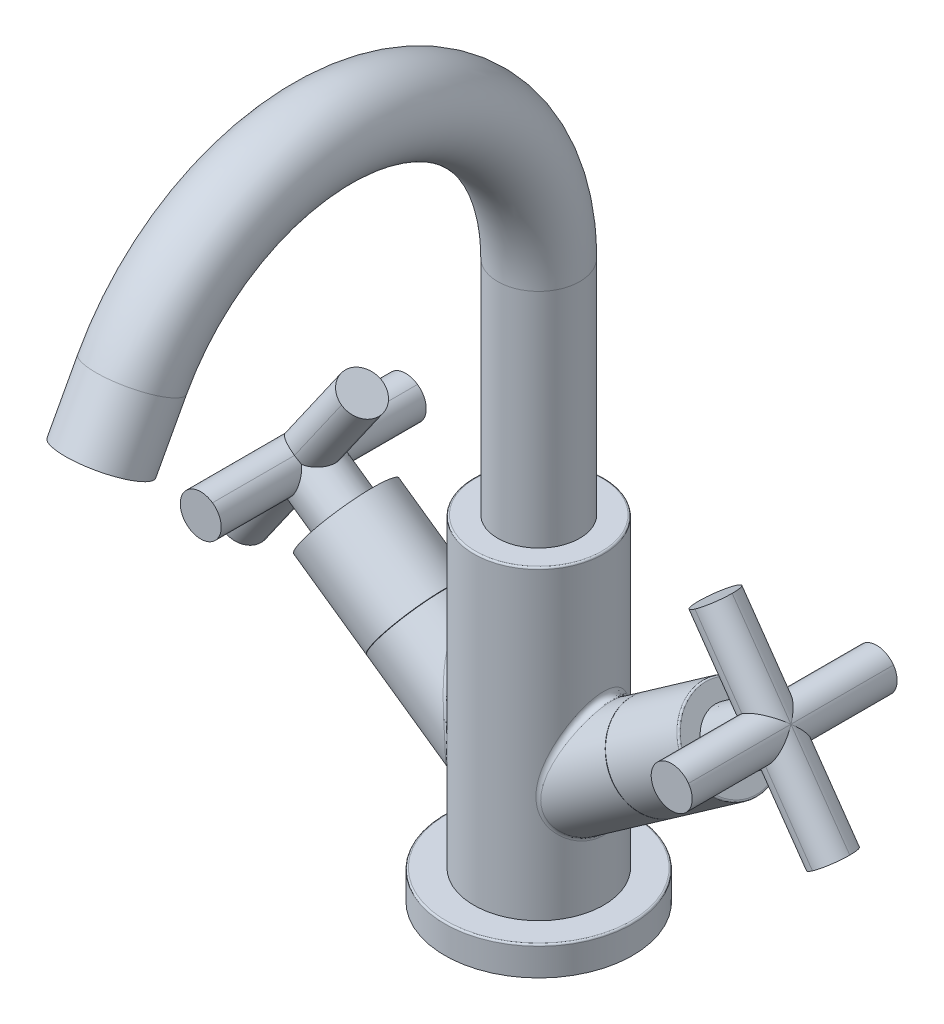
SolidWorks part; units mm, degrees
ref_plane "Front Plane" through (0, 0, 0) normal (0, 0, 1) x (1, 0, 0)
ref_plane "Top Plane" through (0, 0, 0) normal (0, 1, 0) x (1, 0, 0)
ref_plane "Right Plane" through (0, 0, 0) normal (1, 0, 0) x (0, 0, -1)
sketch "Sketch1" plane through (0, 0, 0) normal (0, 0, 1) x (1, 0, 0)
  line L0 (14, 200) -> (14, 213.1353)
  line L1 (-14, 213.1353) -> (-14, 200)
  line L2 (14, 213.1879) -> (14, 215.7624)
  line L3 (-14, 215.7624) -> (-14, 213.1879)
  line L4 (12, 163.0662) -> (12, 193.8645)
  line L5 (12, 221.898) -> (12, 225)
  line L6 (-12, 225) -> (-12, 221.898)
  line L7 (-12, 193.8645) -> (-12, 163.0662)
  line L8 (27.5, 0) -> (27.5, 8.5)
  line L9 (-27.5, 8.5) -> (-27.5, 0)
  line L10 (19, 65.0251) -> (19, 82.9)
  line L11 (19, 8.5) -> (19, 26.0343)
  line L12 (-19, 26.0343) -> (-19, 8.5)
  line L13 (-19, 82.9) -> (-19, 65.0251)
  line L14 (19, 83) -> (19, 98)
  line L15 (-19, 98) -> (-19, 83)
  line L16 (18, 82.9) -> (18, 83)
  line L17 (-18, 83) -> (-18, 82.9)
  line L18 (-42.6502, 43.5615) -> (-19.8331, 27.5848)
  line L19 (-22.1472, 63.3868) -> (-26.5901, 66.4978)
  line L20 (26.5901, 66.4978) -> (22.1472, 63.3868)
  line L21 (19.8331, 27.5848) -> (42.6502, 43.5615)
  line L22 (-64.0301, 58.5319) -> (-42.7321, 43.6189)
  line L23 (-26.672, 66.5551) -> (-47.9699, 81.4681)
  line L24 (47.9699, 81.4681) -> (26.672, 66.5551)
  line L25 (42.7321, 43.6189) -> (64.0301, 58.5319)
  line L26 (-42.1585, 44.438) -> (-42.0766, 44.3807)
  line L27 (-27.1636, 65.6786) -> (-27.2456, 65.736)
  line L28 (27.2456, 65.736) -> (27.1636, 65.6786)
  line L29 (42.0766, 44.3807) -> (42.1585, 44.438)
  line L30 (12, 98) -> (12, 163.0662)
  line L31 (-12, 163.0662) -> (-12, 98)
  line L34 (59.2319, 81.1747) -> (51.8129, 75.9798)
  line L35 (60.1871, 64.0202) -> (67.6062, 69.2151)
  line L36 (67.5327, 69.2207) -> (80.5797, 50.5876)
  line L37 (90.4095, 57.4706) -> (73.2022, 82.0451)
  line L38 (73.2022, 82.0451) -> (55.9949, 106.6197)
  line L39 (46.1651, 99.7368) -> (59.2121, 81.1037)
  line L40 (-67.6062, 69.2151) -> (-60.1871, 64.0202)
  line L41 (-51.8129, 75.9798) -> (-59.2319, 81.1747)
  line L42 (-73.2022, 82.0451) -> (-90.4095, 57.4706)
  line L43 (-80.5797, 50.5876) -> (-67.5327, 69.2207)
  line L44 (-59.2121, 81.1037) -> (-46.1651, 99.7368)
  line L45 (-55.9949, 106.6197) -> (-73.2022, 82.0451)
  line L48 (14, 213.1353) -> (13.9886, 213.615)
  line L49 (13.9886, 213.615) -> (13.7171, 215.518)
  line L50 (13.7171, 215.518) -> (13.0902, 217.3593)
  line L51 (13.0902, 217.3593) -> (12.1244, 219.0913)
  line L52 (12.1244, 219.0913) -> (10.8445, 220.6689)
  line L53 (10.8445, 220.6689) -> (9.2837, 222.0515)
  line L54 (9.2837, 222.0515) -> (7.4825, 223.2031)
  line L55 (7.4825, 223.2031) -> (5.4875, 224.094)
  line L56 (5.4875, 224.094) -> (3.3504, 224.7011)
  line L57 (3.3504, 224.7011) -> (1.1265, 225.0086)
  line L58 (1.1265, 225.0086) -> (-1.1265, 225.0086)
  line L59 (-1.1265, 225.0086) -> (-3.3504, 224.7011)
  line L60 (-3.3504, 224.7011) -> (-5.4875, 224.094)
  line L61 (-5.4875, 224.094) -> (-7.4825, 223.2031)
  line L62 (-7.4825, 223.2031) -> (-9.2837, 222.0515)
  line L63 (-9.2837, 222.0515) -> (-10.8445, 220.6689)
  line L64 (-10.8445, 220.6689) -> (-12.1244, 219.0913)
  line L65 (-12.1244, 219.0913) -> (-13.0902, 217.3593)
  line L66 (-13.0902, 217.3593) -> (-13.7171, 215.518)
  line L67 (-13.7171, 215.518) -> (-13.9886, 213.615)
  line L68 (-13.9886, 213.615) -> (-14, 213.1353)
  line L69 (-2.2458, 188.2424) -> (0, 188.0881)
  line L70 (0, 188.0881) -> (2.2458, 188.2424)
  line L71 (2.2458, 188.2424) -> (4.4334, 188.7012)
  line L72 (4.4334, 188.7012) -> (6.5061, 189.4526)
  line L73 (6.5061, 189.4526) -> (8.4104, 190.4772)
  line L74 (8.4104, 190.4772) -> (10.0968, 191.7484)
  line L75 (10.0968, 191.7484) -> (11.5218, 193.2333)
  line L76 (11.5218, 193.2333) -> (12.6483, 194.8935)
  line L77 (12.6483, 194.8935) -> (13.4473, 196.6859)
  line L78 (13.4473, 196.6859) -> (13.8979, 198.5642)
  line L79 (13.8979, 198.5642) -> (13.9886, 200.4796)
  line L80 (13.9886, 200.4796) -> (13.7171, 202.3827)
  line L81 (13.7171, 202.3827) -> (13.0902, 204.224)
  line L82 (13.0902, 204.224) -> (12.1244, 205.9559)
  line L83 (12.1244, 205.9559) -> (10.8445, 207.5336)
  line L84 (10.8445, 207.5336) -> (9.2837, 208.9162)
  line L85 (9.2837, 208.9162) -> (7.4825, 210.0678)
  line L86 (7.4825, 210.0678) -> (5.4875, 210.9587)
  line L87 (5.4875, 210.9587) -> (3.3504, 211.5657)
  line L88 (3.3504, 211.5657) -> (1.1265, 211.8732)
  line L89 (1.1265, 211.8732) -> (-1.1265, 211.8732)
  line L90 (-1.1265, 211.8732) -> (-3.3504, 211.5657)
  line L91 (-3.3504, 211.5657) -> (-5.4875, 210.9587)
  line L92 (-5.4875, 210.9587) -> (-7.4825, 210.0678)
  line L93 (-7.4825, 210.0678) -> (-9.2837, 208.9162)
  line L94 (-9.2837, 208.9162) -> (-10.8445, 207.5336)
  line L95 (-10.8445, 207.5336) -> (-12.1244, 205.9559)
  line L96 (-12.1244, 205.9559) -> (-13.0902, 204.224)
  line L97 (-13.0902, 204.224) -> (-13.7171, 202.3827)
  line L98 (-13.7171, 202.3827) -> (-13.9886, 200.4796)
  line L99 (-13.9886, 200.4796) -> (-13.8979, 198.5642)
  line L100 (-13.8979, 198.5642) -> (-13.4473, 196.6859)
  line L101 (-13.4473, 196.6859) -> (-12.6483, 194.8935)
  line L102 (-12.6483, 194.8935) -> (-11.5218, 193.2333)
  line L103 (-11.5218, 193.2333) -> (-10.0968, 191.7484)
  line L104 (-10.0968, 191.7484) -> (-8.4104, 190.4772)
  line L105 (-8.4104, 190.4772) -> (-6.5061, 189.4526)
  line L106 (-6.5061, 189.4526) -> (-4.4334, 188.7012)
  line L107 (-4.4334, 188.7012) -> (-2.2458, 188.2424)
  line L108 (1.9641, 190.7911) -> (0, 190.6407)
  line L109 (0, 190.6407) -> (-1.9641, 190.7911)
  line L110 (-1.9641, 190.7911) -> (-3.8651, 191.2375)
  line L111 (-3.8651, 191.2375) -> (-5.6419, 191.9655)
  line L112 (-5.6419, 191.9655) -> (-7.2373, 192.9518)
  line L113 (-7.2373, 192.9518) -> (-8.6001, 194.1646)
  line L114 (-8.6001, 194.1646) -> (-9.6866, 195.5649)
  line L115 (-9.6866, 195.5649) -> (-10.4616, 197.1078)
  line L116 (-10.4616, 197.1078) -> (-10.9004, 198.7437)
  line L117 (-10.9004, 198.7437) -> (-10.9889, 200.4199)
  line L118 (-10.9889, 200.4199) -> (-10.7242, 202.0827)
  line L119 (-10.7242, 202.0827) -> (-10.1148, 203.6785)
  line L120 (-10.1148, 203.6785) -> (-9.1803, 205.156)
  line L121 (-9.1803, 205.156) -> (-7.9507, 206.4679)
  line L122 (-7.9507, 206.4679) -> (-6.4656, 207.5719)
  line L123 (-6.4656, 207.5719) -> (-4.7727, 208.4325)
  line L124 (-4.7727, 208.4325) -> (-2.9264, 209.022)
  line L125 (-2.9264, 209.022) -> (-0.986, 209.3216)
  line L126 (-0.986, 209.3216) -> (0.986, 209.3216)
  line L127 (0.986, 209.3216) -> (2.9264, 209.022)
  line L128 (2.9264, 209.022) -> (4.7727, 208.4325)
  line L129 (4.7727, 208.4325) -> (6.4656, 207.5719)
  line L130 (6.4656, 207.5719) -> (7.9507, 206.4679)
  line L131 (7.9507, 206.4679) -> (9.1803, 205.156)
  line L132 (9.1803, 205.156) -> (10.1148, 203.6785)
  line L133 (10.1148, 203.6785) -> (10.7242, 202.0827)
  line L134 (10.7242, 202.0827) -> (10.9889, 200.4199)
  line L135 (10.9889, 200.4199) -> (10.9004, 198.7437)
  line L136 (10.9004, 198.7437) -> (10.4616, 197.1078)
  line L137 (10.4616, 197.1078) -> (9.6866, 195.5649)
  line L138 (9.6866, 195.5649) -> (8.6001, 194.1646)
  line L139 (8.6001, 194.1646) -> (7.2373, 192.9518)
  line L140 (7.2373, 192.9518) -> (5.6419, 191.9655)
  line L141 (5.6419, 191.9655) -> (3.8651, 191.2375)
  line L142 (3.8651, 191.2375) -> (1.9641, 190.7911)
  line L143 (-1.8925, 192.1707) -> (0, 192.017)
  line L144 (0, 192.017) -> (1.8925, 192.1707)
  line L145 (1.8925, 192.1707) -> (3.7166, 192.6264)
  line L146 (3.7166, 192.6264) -> (5.4064, 193.3676)
  line L147 (5.4064, 193.3676) -> (6.9008, 194.3676)
  line L148 (6.9008, 194.3676) -> (8.1458, 195.59)
  line L149 (8.1458, 195.59) -> (9.0963, 196.9909)
  line L150 (9.0963, 196.9909) -> (9.7181, 198.5195)
  line L151 (9.7181, 198.5195) -> (9.9887, 200.1206)
  line L152 (9.9887, 200.1206) -> (9.8982, 201.7363)
  line L153 (9.8982, 201.7363) -> (9.45, 203.3082)
  line L154 (9.45, 203.3082) -> (8.6603, 204.7796)
  line L155 (8.6603, 204.7796) -> (7.5575, 206.0973)
  line L156 (7.5575, 206.0973) -> (6.1816, 207.2135)
  line L157 (6.1816, 207.2135) -> (4.5823, 208.088)
  line L158 (4.5823, 208.088) -> (2.8173, 208.6892)
  line L159 (2.8173, 208.6892) -> (0.9506, 208.9954)
  line L160 (0.9506, 208.9954) -> (-0.9506, 208.9954)
  line L161 (-0.9506, 208.9954) -> (-2.8173, 208.6892)
  line L162 (-2.8173, 208.6892) -> (-4.5823, 208.088)
  line L163 (-4.5823, 208.088) -> (-6.1816, 207.2135)
  line L164 (-6.1816, 207.2135) -> (-7.5575, 206.0973)
  line L165 (-7.5575, 206.0973) -> (-8.6603, 204.7796)
  line L166 (-8.6603, 204.7796) -> (-9.45, 203.3082)
  line L167 (-9.45, 203.3082) -> (-9.8982, 201.7363)
  line L168 (-9.8982, 201.7363) -> (-9.9887, 200.1206)
  line L169 (-9.9887, 200.1206) -> (-9.7181, 198.5195)
  line L170 (-9.7181, 198.5195) -> (-9.0963, 196.9909)
  line L171 (-9.0963, 196.9909) -> (-8.1458, 195.59)
  line L172 (-8.1458, 195.59) -> (-6.9008, 194.3676)
  line L173 (-6.9008, 194.3676) -> (-5.4064, 193.3676)
  line L174 (-5.4064, 193.3676) -> (-3.7166, 192.6264)
  line L175 (-3.7166, 192.6264) -> (-1.8925, 192.1707)
  line L176 (0, 192.2797) -> (1.8925, 192.4334)
  line L177 (1.8925, 192.4334) -> (3.7166, 192.8891)
  line L178 (3.7166, 192.8891) -> (5.4064, 193.6303)
  line L179 (5.4064, 193.6303) -> (6.9008, 194.6303)
  line L180 (6.9008, 194.6303) -> (8.1458, 195.8527)
  line L181 (8.1458, 195.8527) -> (9.0963, 197.2536)
  line L182 (9.0963, 197.2536) -> (9.7181, 198.7822)
  line L183 (9.7181, 198.7822) -> (9.9887, 200.3833)
  line L184 (9.9887, 200.3833) -> (10, 200.7881)
  line L185 (-10, 200.7881) -> (-9.9887, 200.3833)
  line L186 (-9.9887, 200.3833) -> (-9.7181, 198.7822)
  line L187 (-9.7181, 198.7822) -> (-9.0963, 197.2536)
  line L188 (-9.0963, 197.2536) -> (-8.1458, 195.8527)
  line L189 (-8.1458, 195.8527) -> (-6.9008, 194.6303)
  line L190 (-6.9008, 194.6303) -> (-5.4064, 193.6303)
  line L191 (-5.4064, 193.6303) -> (-3.7166, 192.8891)
  line L192 (-3.7166, 192.8891) -> (-1.8925, 192.4334)
  line L193 (-1.8925, 192.4334) -> (0, 192.2797)
  line L194 (-2.3925, 207.9754) -> (-3.3925, 207.9754)
  line L195 (-3.3925, 207.9754) -> (-3.3925, 207.1246)
  line L196 (-3.3925, 207.1246) -> (-2.3925, 207.1246)
  line L197 (-2.3925, 207.1246) -> (-2.3925, 207.9754)
  line L198 (-1.4284, 205.7214) -> (-2.4284, 205.7214)
  line L199 (-2.4284, 205.7214) -> (-2.4284, 204.8706)
  line L200 (-2.4284, 204.8706) -> (-1.4284, 204.8706)
  line L201 (-1.4284, 204.8706) -> (-1.4284, 205.7214)
  line L202 (-3.3567, 205.1243) -> (-4.3567, 205.1243)
  line L203 (-4.3567, 205.1243) -> (-4.3567, 204.2734)
  line L204 (-4.3567, 204.2734) -> (-3.3567, 204.2734)
  line L205 (-3.3567, 204.2734) -> (-3.3567, 205.1243)
  line L206 (-6.8242, 204.8114) -> (-7.8242, 204.8114)
  line L207 (-7.8242, 204.8114) -> (-7.8242, 203.9606)
  line L208 (-7.8242, 203.9606) -> (-6.8242, 203.9606)
  line L209 (-6.8242, 203.9606) -> (-6.8242, 204.8114)
  line L210 (-4.3828, 203.6121) -> (-5.3828, 203.6121)
  line L211 (-5.3828, 203.6121) -> (-5.3828, 202.7613)
  line L212 (-5.3828, 202.7613) -> (-4.3828, 202.7613)
  line L213 (-4.3828, 202.7613) -> (-4.3828, 203.6121)
  line L214 (-5.4088, 202.1) -> (-6.4088, 202.1)
  line L215 (-6.4088, 202.1) -> (-6.4088, 201.2492)
  line L216 (-6.4088, 201.2492) -> (-5.4088, 201.2492)
  line L217 (-5.4088, 201.2492) -> (-5.4088, 202.1)
  line L218 (-7.8287, 199.964) -> (-8.8287, 199.964)
  line L219 (-8.8287, 199.964) -> (-8.8287, 199.1132)
  line L220 (-8.8287, 199.1132) -> (-7.8287, 199.1132)
  line L221 (-7.8287, 199.1132) -> (-7.8287, 199.964)
  line L222 (-5.0525, 200.3805) -> (-6.0525, 200.3805)
  line L223 (-6.0525, 200.3805) -> (-6.0525, 199.5297)
  line L224 (-6.0525, 199.5297) -> (-5.0525, 199.5297)
  line L225 (-5.0525, 199.5297) -> (-5.0525, 200.3805)
  line L226 (-4.6962, 198.661) -> (-5.6962, 198.661)
  line L227 (-5.6962, 198.661) -> (-5.6962, 197.8102)
  line L228 (-5.6962, 197.8102) -> (-4.6962, 197.8102)
  line L229 (-4.6962, 197.8102) -> (-4.6962, 198.661)
  line L230 (-4.9362, 195.7012) -> (-5.9362, 195.7012)
  line L231 (-5.9362, 195.7012) -> (-5.9362, 194.8504)
  line L232 (-5.9362, 194.8504) -> (-4.9362, 194.8504)
  line L233 (-4.9362, 194.8504) -> (-4.9362, 195.7012)
  line L234 (-3.1241, 197.5387) -> (-4.1241, 197.5387)
  line L235 (-4.1241, 197.5387) -> (-4.1241, 196.6878)
  line L236 (-4.1241, 196.6878) -> (-3.1241, 196.6878)
  line L237 (-3.1241, 196.6878) -> (-3.1241, 197.5387)
  line L238 (-1.5521, 196.4163) -> (-2.5521, 196.4163)
  line L239 (-2.5521, 196.4163) -> (-2.5521, 195.5655)
  line L240 (-2.5521, 195.5655) -> (-1.5521, 195.5655)
  line L241 (-1.5521, 195.5655) -> (-1.5521, 196.4163)
  line L242 (0.5, 194.0177) -> (-0.5, 194.0177)
  line L243 (-0.5, 194.0177) -> (-0.5, 193.1669)
  line L244 (-0.5, 193.1669) -> (0.5, 193.1669)
  line L245 (0.5, 193.1669) -> (0.5, 194.0177)
  line L246 (0.5, 196.4163) -> (-0.5, 196.4163)
  line L247 (-0.5, 196.4163) -> (-0.5, 195.5655)
  line L248 (-0.5, 195.5655) -> (0.5, 195.5655)
  line L249 (0.5, 195.5655) -> (0.5, 196.4163)
  line L250 (2.5521, 196.4163) -> (1.5521, 196.4163)
  line L251 (1.5521, 196.4163) -> (1.5521, 195.5655)
  line L252 (1.5521, 195.5655) -> (2.5521, 195.5655)
  line L253 (2.5521, 195.5655) -> (2.5521, 196.4163)
  line L254 (-1.4284, 203.1689) -> (-2.4284, 203.1689)
  line L255 (-2.4284, 203.1689) -> (-2.4284, 202.3181)
  line L256 (-2.4284, 202.3181) -> (-1.4284, 202.3181)
  line L257 (-1.4284, 202.3181) -> (-1.4284, 203.1689)
  line L258 (5.9362, 195.7012) -> (4.9362, 195.7012)
  line L259 (4.9362, 195.7012) -> (4.9362, 194.8504)
  line L260 (4.9362, 194.8504) -> (5.9362, 194.8504)
  line L261 (5.9362, 194.8504) -> (5.9362, 195.7012)
  line L262 (4.1241, 197.5387) -> (3.1241, 197.5387)
  line L263 (3.1241, 197.5387) -> (3.1241, 196.6878)
  line L264 (3.1241, 196.6878) -> (4.1241, 196.6878)
  line L265 (4.1241, 196.6878) -> (4.1241, 197.5387)
  line L266 (-2.4544, 201.6568) -> (-3.4544, 201.6568)
  line L267 (-3.4544, 201.6568) -> (-3.4544, 200.806)
  line L268 (-3.4544, 200.806) -> (-2.4544, 200.806)
  line L269 (-2.4544, 200.806) -> (-2.4544, 201.6568)
  line L270 (5.6962, 198.661) -> (4.6962, 198.661)
  line L271 (4.6962, 198.661) -> (4.6962, 197.8102)
  line L272 (4.6962, 197.8102) -> (5.6962, 197.8102)
  line L273 (5.6962, 197.8102) -> (5.6962, 198.661)
  line L274 (-2.0981, 199.9373) -> (-3.0981, 199.9373)
  line L275 (-3.0981, 199.9373) -> (-3.0981, 199.0864)
  line L276 (-3.0981, 199.0864) -> (-2.0981, 199.0864)
  line L277 (-2.0981, 199.0864) -> (-2.0981, 199.9373)
  line L278 (8.8287, 199.964) -> (7.8287, 199.964)
  line L279 (7.8287, 199.964) -> (7.8287, 199.1132)
  line L280 (7.8287, 199.1132) -> (8.8287, 199.1132)
  line L281 (8.8287, 199.1132) -> (8.8287, 199.964)
  line L282 (6.0525, 200.3805) -> (5.0525, 200.3805)
  line L283 (5.0525, 200.3805) -> (5.0525, 199.5297)
  line L284 (5.0525, 199.5297) -> (6.0525, 199.5297)
  line L285 (6.0525, 199.5297) -> (6.0525, 200.3805)
  line L286 (-0.5261, 198.815) -> (-1.5261, 198.815)
  line L287 (-1.5261, 198.815) -> (-1.5261, 197.9641)
  line L288 (-1.5261, 197.9641) -> (-0.5261, 197.9641)
  line L289 (-0.5261, 197.9641) -> (-0.5261, 198.815)
  line L290 (6.4088, 202.1) -> (5.4088, 202.1)
  line L291 (5.4088, 202.1) -> (5.4088, 201.2492)
  line L292 (5.4088, 201.2492) -> (6.4088, 201.2492)
  line L293 (6.4088, 201.2492) -> (6.4088, 202.1)
  line L294 (1.5261, 198.815) -> (0.5261, 198.815)
  line L295 (0.5261, 198.815) -> (0.5261, 197.9641)
  line L296 (0.5261, 197.9641) -> (1.5261, 197.9641)
  line L297 (1.5261, 197.9641) -> (1.5261, 198.815)
  line L298 (7.8242, 204.8114) -> (6.8242, 204.8114)
  line L299 (6.8242, 204.8114) -> (6.8242, 203.9606)
  line L300 (6.8242, 203.9606) -> (7.8242, 203.9606)
  line L301 (7.8242, 203.9606) -> (7.8242, 204.8114)
  line L302 (5.3828, 203.6121) -> (4.3828, 203.6121)
  line L303 (4.3828, 203.6121) -> (4.3828, 202.7613)
  line L304 (4.3828, 202.7613) -> (5.3828, 202.7613)
  line L305 (5.3828, 202.7613) -> (5.3828, 203.6121)
  line L306 (3.0981, 199.9373) -> (2.0981, 199.9373)
  line L307 (2.0981, 199.9373) -> (2.0981, 199.0864)
  line L308 (2.0981, 199.0864) -> (3.0981, 199.0864)
  line L309 (3.0981, 199.0864) -> (3.0981, 199.9373)
  line L310 (4.3567, 205.1243) -> (3.3567, 205.1243)
  line L311 (3.3567, 205.1243) -> (3.3567, 204.2734)
  line L312 (3.3567, 204.2734) -> (4.3567, 204.2734)
  line L313 (4.3567, 204.2734) -> (4.3567, 205.1243)
  line L314 (3.4544, 201.6568) -> (2.4544, 201.6568)
  line L315 (2.4544, 201.6568) -> (2.4544, 200.806)
  line L316 (2.4544, 200.806) -> (3.4544, 200.806)
  line L317 (3.4544, 200.806) -> (3.4544, 201.6568)
  line L318 (3.3925, 207.9754) -> (2.3925, 207.9754)
  line L319 (2.3925, 207.9754) -> (2.3925, 207.1246)
  line L320 (2.3925, 207.1246) -> (3.3925, 207.1246)
  line L321 (3.3925, 207.1246) -> (3.3925, 207.9754)
  line L322 (2.4284, 205.7214) -> (1.4284, 205.7214)
  line L323 (1.4284, 205.7214) -> (1.4284, 204.8706)
  line L324 (1.4284, 204.8706) -> (2.4284, 204.8706)
  line L325 (2.4284, 204.8706) -> (2.4284, 205.7214)
  line L326 (2.4284, 203.1689) -> (1.4284, 203.1689)
  line L327 (1.4284, 203.1689) -> (1.4284, 202.3181)
  line L328 (1.4284, 202.3181) -> (2.4284, 202.3181)
  line L329 (2.4284, 202.3181) -> (2.4284, 203.1689)
  line L330 (0.5, 206.3186) -> (-0.5, 206.3186)
  line L331 (-0.5, 206.3186) -> (-0.5, 205.4678)
  line L332 (-0.5, 205.4678) -> (0.5, 205.4678)
  line L333 (0.5, 205.4678) -> (0.5, 206.3186)
  line L334 (0.5, 201.2135) -> (-0.5, 201.2135)
  line L335 (-0.5, 201.2135) -> (-0.5, 200.3627)
  line L336 (-0.5, 200.3627) -> (0.5, 200.3627)
  line L337 (0.5, 200.3627) -> (0.5, 201.2135)
  line L338 (0.5, 203.7661) -> (-0.5, 203.7661)
  line L339 (-0.5, 203.7661) -> (-0.5, 202.9152)
  line L340 (-0.5, 202.9152) -> (0.5, 202.9152)
  line L341 (0.5, 202.9152) -> (0.5, 203.7661)
  line L342 (14, 213.1879) -> (13.9886, 213.6675)
  line L343 (13.9886, 213.6675) -> (13.7171, 215.5706)
  line L344 (13.7171, 215.5706) -> (13.0902, 217.4119)
  line L345 (13.0902, 217.4119) -> (12.1244, 219.1438)
  line L346 (12.1244, 219.1438) -> (10.8445, 220.7215)
  line L347 (10.8445, 220.7215) -> (9.2837, 222.104)
  line L348 (9.2837, 222.104) -> (7.4825, 223.2557)
  line L349 (7.4825, 223.2557) -> (5.4875, 224.1465)
  line L350 (5.4875, 224.1465) -> (3.3504, 224.7536)
  line L351 (3.3504, 224.7536) -> (1.1265, 225.0611)
  line L352 (1.1265, 225.0611) -> (-1.1265, 225.0611)
  line L353 (-1.1265, 225.0611) -> (-3.3504, 224.7536)
  line L354 (-3.3504, 224.7536) -> (-5.4875, 224.1465)
  line L355 (-5.4875, 224.1465) -> (-7.4825, 223.2557)
  line L356 (-7.4825, 223.2557) -> (-9.2837, 222.104)
  line L357 (-9.2837, 222.104) -> (-10.8445, 220.7215)
  line L358 (-10.8445, 220.7215) -> (-12.1244, 219.1438)
  line L359 (-12.1244, 219.1438) -> (-13.0902, 217.4119)
  line L360 (-13.0902, 217.4119) -> (-13.7171, 215.5706)
  line L361 (-13.7171, 215.5706) -> (-13.9886, 213.6675)
  line L362 (-13.9886, 213.6675) -> (-14, 213.1879)
  line L363 (14, 215.7624) -> (13.9886, 216.242)
  line L364 (13.9886, 216.242) -> (13.7171, 218.1451)
  line L365 (13.7171, 218.1451) -> (13.0902, 219.9864)
  line L366 (13.0902, 219.9864) -> (12.1244, 221.7183)
  line L367 (12.1244, 221.7183) -> (10.8445, 223.296)
  line L368 (10.8445, 223.296) -> (9.2837, 224.6786)
  line L369 (9.2837, 224.6786) -> (7.4825, 225.8302)
  line L370 (7.4825, 225.8302) -> (5.4875, 226.7211)
  line L371 (5.4875, 226.7211) -> (3.3504, 227.3281)
  line L372 (3.3504, 227.3281) -> (1.1265, 227.6356)
  line L373 (1.1265, 227.6356) -> (-1.1265, 227.6356)
  line L374 (-1.1265, 227.6356) -> (-3.3504, 227.3281)
  line L375 (-3.3504, 227.3281) -> (-5.4875, 226.7211)
  line L376 (-5.4875, 226.7211) -> (-7.4825, 225.8302)
  line L377 (-7.4825, 225.8302) -> (-9.2837, 224.6786)
  line L378 (-9.2837, 224.6786) -> (-10.8445, 223.296)
  line L379 (-10.8445, 223.296) -> (-12.1244, 221.7183)
  line L380 (-12.1244, 221.7183) -> (-13.0902, 219.9864)
  line L381 (-13.0902, 219.9864) -> (-13.7171, 218.1451)
  line L382 (-13.7171, 218.1451) -> (-13.9886, 216.242)
  line L383 (-13.9886, 216.242) -> (-14, 215.7624)
  line L384 (27.5, 0) -> (-27.5, 0)
  line L385 (27.5, 8.5) -> (-27.5, 8.5)
  line L386 (18.9131, 26.0477) -> (18.9265, 26.0343)
  line L387 (-18.9132, 26.0477) -> (-18.9265, 26.0343)
  line L388 (19, 82.9) -> (-19, 82.9)
  line L389 (19, 83) -> (-19, 83)
  line L390 (19, 98) -> (-19, 98)
  line L391 (-26.5901, 66.4978) -> (-26.694, 66.3493)
  line L392 (-26.694, 66.3493) -> (-27.0033, 65.9076)
  line L393 (-27.0033, 65.9076) -> (-27.5099, 65.1842)
  line L394 (-27.5099, 65.1842) -> (-28.2006, 64.1978)
  line L395 (-28.2006, 64.1978) -> (-29.0575, 62.9739)
  line L396 (-29.0575, 62.9739) -> (-30.0585, 61.5443)
  line L397 (-30.0585, 61.5443) -> (-31.1777, 59.946)
  line L398 (-31.1777, 59.946) -> (-32.386, 58.2203)
  line L399 (-32.386, 58.2203) -> (-33.6522, 56.412)
  line L400 (-33.6522, 56.412) -> (-34.9435, 54.5679)
  line L401 (-34.9435, 54.5679) -> (-36.2264, 52.7357)
  line L402 (-36.2264, 52.7357) -> (-37.4676, 50.963)
  line L403 (-37.4676, 50.963) -> (-38.6352, 49.2956)
  line L404 (-38.6352, 49.2956) -> (-39.6987, 47.7767)
  line L405 (-39.6987, 47.7767) -> (-40.6307, 46.4456)
  line L406 (-40.6307, 46.4456) -> (-41.4071, 45.3369)
  line L407 (-41.4071, 45.3369) -> (-42.0076, 44.4792)
  line L408 (-42.0076, 44.4792) -> (-42.4169, 43.8948)
  line L409 (-42.4169, 43.8948) -> (-42.6242, 43.5987)
  line L410 (-42.6242, 43.5987) -> (-42.6502, 43.5615)
  line L411 (26.5901, 66.4978) -> (26.694, 66.3493)
  line L412 (26.694, 66.3493) -> (27.0033, 65.9076)
  line L413 (27.0033, 65.9076) -> (27.5099, 65.1842)
  line L414 (27.5099, 65.1842) -> (28.2006, 64.1978)
  line L415 (28.2006, 64.1978) -> (29.0575, 62.9739)
  line L416 (29.0575, 62.9739) -> (30.0585, 61.5443)
  line L417 (30.0585, 61.5443) -> (31.1777, 59.946)
  line L418 (31.1777, 59.946) -> (32.386, 58.2203)
  line L419 (32.386, 58.2203) -> (33.6522, 56.412)
  line L420 (33.6522, 56.412) -> (34.9435, 54.5679)
  line L421 (34.9435, 54.5679) -> (36.2264, 52.7357)
  line L422 (36.2264, 52.7357) -> (37.4676, 50.963)
  line L423 (37.4676, 50.963) -> (38.6352, 49.2956)
  line L424 (38.6352, 49.2956) -> (39.6987, 47.7767)
  line L425 (39.6987, 47.7767) -> (40.6307, 46.4456)
  line L426 (40.6307, 46.4456) -> (41.4071, 45.3369)
  line L427 (41.4071, 45.3369) -> (42.0076, 44.4792)
  line L428 (42.0076, 44.4792) -> (42.4169, 43.8948)
  line L429 (42.4169, 43.8948) -> (42.6242, 43.5987)
  line L430 (42.6242, 43.5987) -> (42.6502, 43.5615)
  line L431 (-26.672, 66.5551) -> (-26.776, 66.4066)
  line L432 (-26.776, 66.4066) -> (-27.0852, 65.965)
  line L433 (-27.0852, 65.965) -> (-27.5918, 65.2415)
  line L434 (-27.5918, 65.2415) -> (-28.2825, 64.2551)
  line L435 (-28.2825, 64.2551) -> (-29.1394, 63.0313)
  line L436 (-29.1394, 63.0313) -> (-30.1404, 61.6017)
  line L437 (-30.1404, 61.6017) -> (-31.2596, 60.0033)
  line L438 (-31.2596, 60.0033) -> (-32.4679, 58.2776)
  line L439 (-32.4679, 58.2776) -> (-33.7341, 56.4693)
  line L440 (-33.7341, 56.4693) -> (-35.0254, 54.6252)
  line L441 (-35.0254, 54.6252) -> (-36.3083, 52.7931)
  line L442 (-36.3083, 52.7931) -> (-37.5495, 51.0204)
  line L443 (-37.5495, 51.0204) -> (-38.7171, 49.353)
  line L444 (-38.7171, 49.353) -> (-39.7806, 47.834)
  line L445 (-39.7806, 47.834) -> (-40.7126, 46.503)
  line L446 (-40.7126, 46.503) -> (-41.489, 45.3943)
  line L447 (-41.489, 45.3943) -> (-42.0895, 44.5366)
  line L448 (-42.0895, 44.5366) -> (-42.4988, 43.9521)
  line L449 (-42.4988, 43.9521) -> (-42.7061, 43.6561)
  line L450 (-42.7061, 43.6561) -> (-42.7321, 43.6189)
  line L451 (-47.9699, 81.4681) -> (-48.0739, 81.3196)
  line L452 (-48.0739, 81.3196) -> (-48.3832, 80.8779)
  line L453 (-48.3832, 80.8779) -> (-48.8897, 80.1545)
  line L454 (-48.8897, 80.1545) -> (-49.5804, 79.1681)
  line L455 (-49.5804, 79.1681) -> (-50.4374, 77.9443)
  line L456 (-50.4374, 77.9443) -> (-51.4384, 76.5146)
  line L457 (-51.4384, 76.5146) -> (-52.5576, 74.9163)
  line L458 (-52.5576, 74.9163) -> (-53.7659, 73.1906)
  line L459 (-53.7659, 73.1906) -> (-55.0321, 71.3823)
  line L460 (-55.0321, 71.3823) -> (-56.3233, 69.5382)
  line L461 (-56.3233, 69.5382) -> (-57.6062, 67.7061)
  line L462 (-57.6062, 67.7061) -> (-58.8475, 65.9334)
  line L463 (-58.8475, 65.9334) -> (-60.015, 64.2659)
  line L464 (-60.015, 64.2659) -> (-61.0786, 62.747)
  line L465 (-61.0786, 62.747) -> (-62.0106, 61.416)
  line L466 (-62.0106, 61.416) -> (-62.7869, 60.3073)
  line L467 (-62.7869, 60.3073) -> (-63.3875, 59.4496)
  line L468 (-63.3875, 59.4496) -> (-63.7967, 58.8651)
  line L469 (-63.7967, 58.8651) -> (-64.004, 58.5691)
  line L470 (-64.004, 58.5691) -> (-64.0301, 58.5319)
  line L471 (26.672, 66.5551) -> (26.776, 66.4066)
  line L472 (26.776, 66.4066) -> (27.0852, 65.965)
  line L473 (27.0852, 65.965) -> (27.5918, 65.2415)
  line L474 (27.5918, 65.2415) -> (28.2825, 64.2551)
  line L475 (28.2825, 64.2551) -> (29.1394, 63.0313)
  line L476 (29.1394, 63.0313) -> (30.1404, 61.6017)
  line L477 (30.1404, 61.6017) -> (31.2596, 60.0033)
  line L478 (31.2596, 60.0033) -> (32.4679, 58.2776)
  line L479 (32.4679, 58.2776) -> (33.7341, 56.4693)
  line L480 (33.7341, 56.4693) -> (35.0254, 54.6252)
  line L481 (35.0254, 54.6252) -> (36.3083, 52.7931)
  line L482 (36.3083, 52.7931) -> (37.5495, 51.0204)
  line L483 (37.5495, 51.0204) -> (38.7171, 49.353)
  line L484 (38.7171, 49.353) -> (39.7806, 47.834)
  line L485 (39.7806, 47.834) -> (40.7126, 46.503)
  line L486 (40.7126, 46.503) -> (41.489, 45.3943)
  line L487 (41.489, 45.3943) -> (42.0895, 44.5366)
  line L488 (42.0895, 44.5366) -> (42.4988, 43.9521)
  line L489 (42.4988, 43.9521) -> (42.7061, 43.6561)
  line L490 (42.7061, 43.6561) -> (42.7321, 43.6189)
  line L491 (47.9699, 81.4681) -> (48.0739, 81.3196)
  line L492 (48.0739, 81.3196) -> (48.3832, 80.8779)
  line L493 (48.3832, 80.8779) -> (48.8897, 80.1545)
  line L494 (48.8897, 80.1545) -> (49.5804, 79.1681)
  line L495 (49.5804, 79.1681) -> (50.4374, 77.9443)
  line L496 (50.4374, 77.9443) -> (51.4384, 76.5146)
  line L497 (51.4384, 76.5146) -> (52.5576, 74.9163)
  line L498 (52.5576, 74.9163) -> (53.7659, 73.1906)
  line L499 (53.7659, 73.1906) -> (55.0321, 71.3823)
  line L500 (55.0321, 71.3823) -> (56.3233, 69.5382)
  line L501 (56.3233, 69.5382) -> (57.6062, 67.7061)
  line L502 (57.6062, 67.7061) -> (58.8475, 65.9334)
  line L503 (58.8475, 65.9334) -> (60.015, 64.2659)
  line L504 (60.015, 64.2659) -> (61.0786, 62.747)
  line L505 (61.0786, 62.747) -> (62.0106, 61.416)
  line L506 (62.0106, 61.416) -> (62.7869, 60.3073)
  line L507 (62.7869, 60.3073) -> (63.3875, 59.4496)
  line L508 (63.3875, 59.4496) -> (63.7967, 58.8651)
  line L509 (63.7967, 58.8651) -> (64.004, 58.5691)
  line L510 (64.004, 58.5691) -> (64.0301, 58.5319)
  line L515 (90.4095, 57.4706) -> (90.3707, 57.4434)
  line L516 (90.3707, 57.4434) -> (90.0643, 57.2289)
  line L517 (90.0643, 57.2289) -> (89.4708, 56.8133)
  line L518 (89.4708, 56.8133) -> (88.6275, 56.2228)
  line L519 (88.6275, 56.2228) -> (87.5872, 55.4944)
  line L520 (87.5872, 55.4944) -> (86.4155, 54.6739)
  line L521 (86.4155, 54.6739) -> (85.186, 53.813)
  line L522 (85.186, 53.813) -> (83.9758, 52.9656)
  line L523 (83.9758, 52.9656) -> (82.861, 52.1851)
  line L524 (82.861, 52.1851) -> (81.9118, 51.5204)
  line L525 (81.9118, 51.5204) -> (81.1876, 51.0133)
  line L526 (81.1876, 51.0133) -> (80.7341, 50.6958)
  line L527 (80.7341, 50.6958) -> (80.5797, 50.5876)
  line L528 (46.1651, 99.7368) -> (46.3195, 99.8449)
  line L529 (46.3195, 99.8449) -> (46.773, 100.1624)
  line L530 (46.773, 100.1624) -> (47.4972, 100.6695)
  line L531 (47.4972, 100.6695) -> (48.4464, 101.3342)
  line L532 (48.4464, 101.3342) -> (49.5612, 102.1147)
  line L533 (49.5612, 102.1147) -> (50.7714, 102.9621)
  line L534 (50.7714, 102.9621) -> (52.001, 103.8231)
  line L535 (52.001, 103.8231) -> (53.1727, 104.6435)
  line L536 (53.1727, 104.6435) -> (54.2129, 105.3719)
  line L537 (54.2129, 105.3719) -> (55.0562, 105.9624)
  line L538 (55.0562, 105.9624) -> (55.6498, 106.378)
  line L539 (55.6498, 106.378) -> (55.9561, 106.5925)
  line L540 (55.9561, 106.5925) -> (55.9949, 106.6197)
  line L541 (-80.5797, 50.5876) -> (-80.7341, 50.6958)
  line L542 (-80.7341, 50.6958) -> (-81.1876, 51.0133)
  line L543 (-81.1876, 51.0133) -> (-81.9118, 51.5204)
  line L544 (-81.9118, 51.5204) -> (-82.861, 52.1851)
  line L545 (-82.861, 52.1851) -> (-83.9758, 52.9656)
  line L546 (-83.9758, 52.9656) -> (-85.186, 53.813)
  line L547 (-85.186, 53.813) -> (-86.4155, 54.6739)
  line L548 (-86.4155, 54.6739) -> (-87.5872, 55.4944)
  line L549 (-87.5872, 55.4944) -> (-88.6275, 56.2228)
  line L550 (-88.6275, 56.2228) -> (-89.4708, 56.8133)
  line L551 (-89.4708, 56.8133) -> (-90.0643, 57.2289)
  line L552 (-90.0643, 57.2289) -> (-90.3707, 57.4434)
  line L553 (-90.3707, 57.4434) -> (-90.4095, 57.4706)
  line L554 (-55.9949, 106.6197) -> (-55.9561, 106.5925)
  line L555 (-55.9561, 106.5925) -> (-55.6498, 106.378)
  line L556 (-55.6498, 106.378) -> (-55.0562, 105.9624)
  line L557 (-55.0562, 105.9624) -> (-54.2129, 105.3719)
  line L558 (-54.2129, 105.3719) -> (-53.1727, 104.6435)
  line L559 (-53.1727, 104.6435) -> (-52.001, 103.8231)
  line L560 (-52.001, 103.8231) -> (-50.7714, 102.9621)
  line L561 (-50.7714, 102.9621) -> (-49.5612, 102.1147)
  line L562 (-49.5612, 102.1147) -> (-48.4464, 101.3342)
  line L563 (-48.4464, 101.3342) -> (-47.4972, 100.6695)
  line L564 (-47.4972, 100.6695) -> (-46.773, 100.1624)
  line L565 (-46.773, 100.1624) -> (-46.3195, 99.8449)
  line L566 (-46.3195, 99.8449) -> (-46.1651, 99.7368)
  line L567 (-27.5, 0) -> (27.5, 0)
  line L574 (0, 0) -> (0, 237) construction
  line L575 (-73.2022, 82.0451) -> (0, 30.7884) construction
  line L576 (0, 30.1002) -> (73.5038, 81.5681) construction
  arc A0 (12, 225) -> (-12, 225) centre (0, 225) ccw
  circle A1 centre (68.2873, 78.6037) radius 6
  circle A2 centre (-68.2873, 78.6036) radius 6
  spline S0 degree 3 poles (-19.0066, 65.0118) (-19.0023, 64.9669) (-18.9754, 64.6858) (-19.1461, 64.1481) (-19.5697, 63.5331) (-20.213, 63.1179) (-20.8968, 62.9727) (-21.5009, 63.0532) (-21.9156, 63.2121) (-22.1096, 63.3591) (-22.1742, 63.408) knots 0 0 0 0 0.030683 0.192348 0.368782 0.533189 0.701933 0.834283 0.944803 1 1 1 1
  spline S1 degree 3 poles (-19.8505, 27.5666) (-19.7311, 27.4864) (-19.3966, 27.2619) (-19.1126, 26.7135) (-18.9764, 26.2608) (-18.9914, 26.058) (-18.9917, 26.0538) knots 0 0 0 0 0.236552 0.662253 0.993 1 1 1 1
  spline S2 degree 3 poles (18.9912, 26.0324) (19.021, 26.2511) (19.0834, 26.7088) (19.4049, 27.2622) (19.7283, 27.482) (19.8518, 27.5659) knots 0 0 0 0 0.361449 0.756313 1 1 1 1
  spline S3 degree 3 poles (22.1634, 63.4054) (22.108, 63.3611) (21.8779, 63.1771) (21.3625, 63.0094) (20.6591, 62.9923) (19.9807, 63.2345) (19.4661, 63.665) (19.1606, 64.1558) (19.0137, 64.6048) (18.9999, 64.8867) (18.9937, 65.0126) knots 0 0 0 0 0.04838 0.200902 0.358443 0.523192 0.681258 0.807671 0.914101 1 1 1 1
  spline S4 degree 3 poles (59.2588, 81.1364) (59.2674, 81.1357) (59.4613, 81.1211) (60.0023, 81.0836) (61.0862, 81.0311) (62.0819, 81.0269) (62.7267, 81.0712) (62.8211, 81.0777) knots 0 0 0 0 0.007268 0.163613 0.456283 0.920362 1 1 1 1
  spline S5 degree 3 poles (68.7426, 72.621) (68.4929, 71.9852) (68.2433, 71.3494) (68.084, 70.9103) knots 0 0 0 0 0.508691 0.508691 0.508691 0.508691
  spline S6 degree 3 poles (68.084, 70.9103) (67.9778, 70.6174) (67.9117, 70.4121) (67.7198, 69.7436) knots 0.508691 0.508691 0.508691 0.508691 0.847859 0.847859 0.847859 0.847859
  spline S7 degree 3 poles (67.7198, 69.7436) (67.6368, 69.4542) (67.5301, 69.078) (67.5742, 69.2349) knots 0.847859 0.847859 0.847859 0.847859 0.994683 0.994683 0.994683 0.994683
  spline S8 degree 3 poles (67.5742, 69.2349) (67.5758, 69.2406) (67.5775, 69.247) (67.5793, 69.2534) knots 0.994683 0.994683 0.994683 0.994683 1 1 1 1
  spline S9 degree 3 poles (-62.8211, 81.0777) (-62.1383, 81.0605) (-61.4555, 81.0434) (-60.9883, 81.0439) knots 0 0 0 0 0.508693 0.508693 0.508693 0.508693
  spline S10 degree 3 poles (-60.9883, 81.0439) (-60.6768, 81.0442) (-60.4612, 81.0524) (-59.7674, 81.1008) knots 0.508693 0.508693 0.508693 0.508693 0.847859 0.847859 0.847859 0.847859
  spline S11 degree 3 poles (-59.7674, 81.1008) (-59.4671, 81.1217) (-59.0771, 81.1501) (-59.2397, 81.1378) knots 0.847859 0.847859 0.847859 0.847859 0.994683 0.994683 0.994683 0.994683
  spline S12 degree 3 poles (-59.2397, 81.1378) (-59.2455, 81.1374) (-59.2521, 81.1369) (-59.2588, 81.1364) knots 0.994683 0.994683 0.994683 0.994683 1 1 1 1
  spline S13 degree 3 poles (-67.5793, 69.2534) (-67.5817, 69.2617) (-67.6342, 69.4489) (-67.784, 69.9701) (-68.1054, 71.0066) (-68.442, 71.9437) (-68.7042, 72.5344) (-68.7426, 72.621) knots 0 0 0 0 0.007271 0.163615 0.456284 0.920362 1 1 1 1
sketch "Sketch2" plane through (0, 0, 0) normal (1, 0, 0) x (0, 0, -1)
  line L0 (14, 70) -> (14, 55.087)
  line L1 (-14, 55.087) -> (-14, 70)
  line L2 (14, 55.0297) -> (14, 40.3403)
  line L3 (-14, 40.3302) -> (-14, 55.0297)
  line L4 (-27.5, 0) -> (-27.5, 8.5)
  line L5 (27.5, 8.5) -> (27.5, 0)
  line L6 (-19, 8.5) -> (-19, 72.6037)
  line L7 (19, 28.2456) -> (19, 8.5)
  line L8 (19, 72.6037) -> (19, 46.4836)
  line L9 (-19, 84.6036) -> (-19, 98)
  line L10 (19, 98) -> (19, 84.6036)
  line L17 (-12, 98) -> (-12, 163.0662)
  line L18 (12, 163.0662) -> (12, 98)
  line L23 (23.1276, 38.7662) -> (18.9578, 28.9428)
  line L24 (6, 73.6887) -> (6, 54.0291)
  line L25 (-6, 54.0291) -> (-6, 73.6887)
  line L26 (4.9149, 84.6036) -> (30, 84.6036)
  line L27 (30, 72.6037) -> (6, 72.6037)
  line L28 (-30, 84.6036) -> (-4.9149, 84.6036)
  line L29 (-6, 72.6037) -> (-30, 72.6037)
  line L30 (-6, 84.6036) -> (-6, 103.1782)
  line L31 (6, 103.1782) -> (6, 84.6036)
  line L32 (7.3, 72.6037) -> (7.3, 70)
  line L33 (-7.3, 70) -> (-7.3, 72.6037)
  line L34 (27.4998, 0) -> (27.5, 0)
  line L35 (-27.5, 0) -> (-27.4998, 0)
  line L36 (-13.6344, 72.6037) -> (-13.8979, 71.3823)
  line L37 (-13.8979, 71.3823) -> (-13.9886, 69.5382)
  line L38 (-13.9886, 69.5382) -> (-13.7171, 67.7061)
  line L39 (-13.7171, 67.7061) -> (-13.0902, 65.9334)
  line L40 (-13.0902, 65.9334) -> (-12.1244, 64.2659)
  line L41 (-12.1244, 64.2659) -> (-10.8445, 62.747)
  line L42 (-10.8445, 62.747) -> (-9.2837, 61.416)
  line L43 (-9.2837, 61.416) -> (-7.4825, 60.3073)
  line L44 (-7.4825, 60.3073) -> (-6, 59.6385)
  line L45 (6, 59.6385) -> (7.4825, 60.3073)
  line L46 (7.4825, 60.3073) -> (9.2837, 61.416)
  line L47 (9.2837, 61.416) -> (10.8445, 62.747)
  line L48 (10.8445, 62.747) -> (12.1244, 64.2659)
  line L49 (12.1244, 64.2659) -> (13.0902, 65.9334)
  line L50 (13.0902, 65.9334) -> (13.7171, 67.7061)
  line L51 (13.7171, 67.7061) -> (13.9886, 69.5382)
  line L52 (13.9886, 69.5382) -> (13.8979, 71.3823)
  line L53 (13.8979, 71.3823) -> (13.6344, 72.6037)
  line L54 (-14, 55.087) -> (-13.9886, 54.6252)
  line L55 (-13.9886, 54.6252) -> (-13.7171, 52.7931)
  line L56 (-13.7171, 52.7931) -> (-13.0902, 51.0204)
  line L57 (-13.0902, 51.0204) -> (-12.1244, 49.353)
  line L58 (-12.1244, 49.353) -> (-10.8445, 47.834)
  line L59 (-10.8445, 47.834) -> (-9.2837, 46.503)
  line L60 (-9.2837, 46.503) -> (-7.4825, 45.3943)
  line L61 (-7.4825, 45.3943) -> (-5.4875, 44.5366)
  line L62 (-5.4875, 44.5366) -> (-3.3504, 43.9521)
  line L63 (-3.3504, 43.9521) -> (-1.1265, 43.6561)
  line L64 (-1.1265, 43.6561) -> (1.1265, 43.6561)
  line L65 (1.1265, 43.6561) -> (3.3504, 43.9521)
  line L66 (3.3504, 43.9521) -> (5.4875, 44.5366)
  line L67 (5.4875, 44.5366) -> (7.4825, 45.3943)
  line L68 (7.4825, 45.3943) -> (9.2837, 46.503)
  line L69 (9.2837, 46.503) -> (10.8445, 47.834)
  line L70 (10.8445, 47.834) -> (12.1244, 49.353)
  line L71 (12.1244, 49.353) -> (13.0902, 51.0204)
  line L72 (13.0902, 51.0204) -> (13.7171, 52.7931)
  line L73 (13.7171, 52.7931) -> (13.9886, 54.6252)
  line L74 (13.9886, 54.6252) -> (14, 55.087)
  line L75 (-14, 55.0297) -> (-13.9886, 54.5679)
  line L76 (-13.9886, 54.5679) -> (-13.7171, 52.7357)
  line L77 (-13.7171, 52.7357) -> (-13.0902, 50.963)
  line L78 (-13.0902, 50.963) -> (-12.1244, 49.2956)
  line L79 (-12.1244, 49.2956) -> (-10.8445, 47.7767)
  line L80 (-10.8445, 47.7767) -> (-9.2837, 46.4456)
  line L81 (-9.2837, 46.4456) -> (-7.4825, 45.3369)
  line L82 (-7.4825, 45.3369) -> (-5.4875, 44.4792)
  line L83 (-5.4875, 44.4792) -> (-3.3504, 43.8948)
  line L84 (-3.3504, 43.8948) -> (-1.1265, 43.5987)
  line L85 (-1.1265, 43.5987) -> (1.1265, 43.5987)
  line L86 (1.1265, 43.5987) -> (3.3504, 43.8948)
  line L87 (3.3504, 43.8948) -> (5.4875, 44.4792)
  line L88 (5.4875, 44.4792) -> (7.4825, 45.3369)
  line L89 (7.4825, 45.3369) -> (9.2837, 46.4456)
  line L90 (9.2837, 46.4456) -> (10.8445, 47.7767)
  line L91 (10.8445, 47.7767) -> (12.1244, 49.2956)
  line L92 (12.1244, 49.2956) -> (13.0902, 50.963)
  line L93 (13.0902, 50.963) -> (13.7171, 52.7357)
  line L94 (13.7171, 52.7357) -> (13.9886, 54.5679)
  line L95 (13.9886, 54.5679) -> (14, 55.0297)
  line L96 (-13.9754, 40.0468) -> (-13.9811, 40.3306)
  line L97 (-27.4998, 0) -> (27.4998, 0)
  line L98 (-27.5, 8.5) -> (27.5, 8.5)
  line L99 (-19, 98) -> (-6, 98)
  line L100 (6, 98) -> (19, 98)
  line L184 (-13.9703, 40.3389) -> (-13.9766, 40.106)
  line L187 (1.4921, 50.6958) -> (0, 50.5876)
  line L188 (0, 50.5876) -> (-1.4921, 50.6958)
  line L189 (-1.4921, 50.6958) -> (-2.8905, 51.0133)
  line L190 (-2.8905, 51.0133) -> (-4.1073, 51.5204)
  line L191 (-4.1073, 51.5204) -> (-5.066, 52.1851)
  line L192 (-5.066, 52.1851) -> (-5.7063, 52.9656)
  line L193 (-5.7063, 52.9656) -> (-5.9882, 53.813)
  line L194 (-5.9882, 53.813) -> (-5.8937, 54.6739)
  line L195 (-5.8937, 54.6739) -> (-5.429, 55.4944)
  line L196 (-5.429, 55.4944) -> (-4.6231, 56.2228)
  line L197 (-4.6231, 56.2228) -> (-3.5267, 56.8133)
  line L198 (-3.5267, 56.8133) -> (-2.2087, 57.2289)
  line L199 (-2.2087, 57.2289) -> (-0.752, 57.4434)
  line L200 (-0.752, 57.4434) -> (0.752, 57.4434)
  line L201 (0.752, 57.4434) -> (2.2087, 57.2289)
  line L202 (2.2087, 57.2289) -> (3.5267, 56.8133)
  line L203 (3.5267, 56.8133) -> (4.6231, 56.2228)
  line L204 (4.6231, 56.2228) -> (5.429, 55.4944)
  line L205 (5.429, 55.4944) -> (5.8937, 54.6739)
  line L206 (5.8937, 54.6739) -> (5.9882, 53.813)
  line L207 (5.9882, 53.813) -> (5.7063, 52.9656)
  line L208 (5.7063, 52.9656) -> (5.066, 52.1851)
  line L209 (5.066, 52.1851) -> (4.1073, 51.5204)
  line L210 (4.1073, 51.5204) -> (2.8905, 51.0133)
  line L211 (2.8905, 51.0133) -> (1.4921, 50.6958)
  line L212 (0, 82.0451) -> (-1.0475, 81.1342)
  line L213 (-1.0475, 81.1342) -> (-2.0628, 80.1456)
  line L214 (-2.0628, 80.1456) -> (-3.0147, 79.1097)
  line L215 (-3.0147, 79.1097) -> (-3.874, 78.0582)
  line L216 (-3.874, 78.0582) -> (-4.6144, 77.0234)
  line L217 (-4.6144, 77.0234) -> (-5.213, 76.0372)
  line L218 (-5.213, 76.0372) -> (-5.6516, 75.1298)
  line L219 (-5.6516, 75.1298) -> (-5.9165, 74.3291)
  line L220 (-5.9165, 74.3291) -> (-6, 73.6887)
  line L221 (0, 82.0451) -> (1.0475, 81.1342)
  line L222 (1.0475, 81.1342) -> (2.0627, 80.1456)
  line L223 (2.0627, 80.1456) -> (3.0147, 79.1097)
  line L224 (3.0147, 79.1097) -> (3.874, 78.0582)
  line L225 (3.874, 78.0582) -> (4.6144, 77.0234)
  line L226 (4.6144, 77.0234) -> (5.213, 76.0372)
  line L227 (5.213, 76.0372) -> (5.6516, 75.1298)
  line L228 (5.6516, 75.1298) -> (5.9165, 74.3291)
  line L229 (5.9165, 74.3291) -> (6, 73.6887)
  line L230 (30, 72.6037) -> (30, 84.6036)
  line L231 (-30, 84.6036) -> (-30, 72.6037)
  line L250 (0, 106.7111) -> (0, 163.0662) construction
  line L267 (-108.4252, 187.3824) -> (-117.435, 170.6545)
  line L268 (-138.565, 182.0352) -> (-129.5553, 198.7632)
  line L366 (-138.565, 182.0352) -> (-138.4045, 181.9487)
  line L367 (-138.4045, 181.9487) -> (-137.9279, 181.692)
  line L368 (-137.9279, 181.692) -> (-137.1496, 181.2728)
  line L369 (-137.1496, 181.2728) -> (-136.0933, 180.7039)
  line L370 (-136.0933, 180.7039) -> (-134.7911, 180.0025)
  line L371 (-134.7911, 180.0025) -> (-133.2825, 179.19)
  line L372 (-133.2825, 179.19) -> (-131.6134, 178.291)
  line L373 (-131.6134, 178.291) -> (-129.8346, 177.333)
  line L374 (-129.8346, 177.333) -> (-128, 176.3448)
  line L375 (-128, 176.3448) -> (-126.1654, 175.3567)
  line L376 (-126.1654, 175.3567) -> (-124.3865, 174.3986)
  line L377 (-124.3865, 174.3986) -> (-122.7175, 173.4996)
  line L378 (-122.7175, 173.4996) -> (-121.2089, 172.6871)
  line L379 (-121.2089, 172.6871) -> (-119.9067, 171.9858)
  line L380 (-119.9067, 171.9858) -> (-118.8504, 171.4168)
  line L381 (-118.8504, 171.4168) -> (-118.0721, 170.9976)
  line L382 (-118.0721, 170.9976) -> (-117.5955, 170.7409)
  line L383 (-117.5955, 170.7409) -> (-117.435, 170.6545)
  line L509 (-129.8968, 172.8231) -> (-117.0935, 196.5945) construction
  arc A2 (23.1287, 38.7697) -> (19, 46.4836) centre (22.696, 43.5) ccw
  circle A3 centre (22.696, 43.5) radius 1.5
  arc A4 (4.9149, 84.6036) -> (0, 82.0451) centre (6.5656, 75.4327) ccw
  arc A5 (0, 82.0451) -> (-4.9149, 84.6036) centre (-6.5656, 75.4327) ccw
  arc A7 (-6, 103.1782) -> (-4.466, 105.5184) centre (-2.8242, 102.7693) cw
  arc A8 (-4.466, 105.5184) -> (4.466, 105.5184) centre (0, 98.0402) cw
  arc A9 (6, 103.1782) -> (4.466, 105.5184) centre (2.8242, 102.7693) ccw
  arc A10 (-12, 163.0662) -> (-108.4252, 187.3824) centre (-63.2786, 163.0662) ccw
  arc A11 (12, 163.0662) -> (-129.5553, 198.7632) centre (-63.2786, 163.0662) ccw
  arc A12 (0, 163.0662) -> (-118.9902, 193.0728) centre (-63.2786, 163.0662) ccw construction
  spline S0 degree 3 poles (18.774, 34.779) (18.7796, 34.2231) (18.7852, 33.6672) (18.7963, 33.1061) knots 0 0 0 0 0.255042 0.255042 0.255042 0.255042
  spline S1 degree 3 poles (18.7963, 33.1061) (18.8141, 32.2017) (18.846, 31.2838) (18.8838, 30.4108) knots 0.255042 0.255042 0.255042 0.255042 0.666141 0.666141 0.666141 0.666141
  spline S2 degree 3 poles (18.8838, 30.4108) (18.8967, 30.1142) (18.9102, 29.8228) (18.9273, 29.4956) knots 0.666141 0.666141 0.666141 0.666141 0.805807 0.805807 0.805807 0.805807
  spline S3 degree 3 poles (18.9273, 29.4956) (18.9423, 29.2076) (18.9601, 28.8918) (18.9718, 28.69) knots 0.805807 0.805807 0.805807 0.805807 0.928809 0.928809 0.928809 0.928809
  spline S4 degree 3 poles (18.9718, 28.69) (18.9761, 28.6146) (18.9796, 28.5551) (18.9899, 28.3891) knots 0.928809 0.928809 0.928809 0.928809 0.974761 0.974761 0.974761 0.974761
  spline S5 degree 3 poles (18.9996, 28.2348) (18.9994, 28.2379) (18.9992, 28.2417) (18.9989, 28.2456) knots 0.998338 0.998338 0.998338 0.998338 1 1 1 1
  spline S13 degree 3 poles (18.9259, 44.0092) (19.1123, 43.9229) (19.5388, 43.7255) (20.126, 43.449) (20.6243, 43.0495) (21.1386, 42.0837) (21.5711, 40.9026) (22.3176, 39.7743) (22.7801, 39.1912) (23.0197, 38.8629) (23.1209, 38.7764) (23.1287, 38.7697) knots 0 0 0 0 0.088998 0.20358 0.28094 0.360008 0.67178 0.825737 0.942323 0.995574 1 1 1 1
sketch "Sketch3" plane through (0, 0, 0) normal (1, 0, 0) x (0, 0, -1)
  line L0 (0, 0) -> (0, 237) construction
  line L1 (-27.4998, 0) -> (27.4998, 0) construction
  line L2 (-27.5, 0) -> (-27.5, 8.5) construction
  line L3 (-27.5, 8.5) -> (27.5, 8.5) construction
  line L4 (0, 0) -> (0, 98)
  line L5 (-27.4998, 0) -> (0, 0)
  line L6 (-27.5, 0) -> (-27.5, 8.5)
  line L7 (-27.5, 8.5) -> (-19, 8.5)
  line L8 (-19, 8.5) -> (-19, 72.6037) construction
  line L9 (-19, 8.5) -> (-19, 98)
  line L10 (-19, 98) -> (-6, 98) construction
  line L11 (-19, 98) -> (0, 98)
  line L12 (0, 0) -> (0, 127.6506) construction
  line L13 (-27.4998, 0) -> (-27.5, 0)
revolve "Revolve1" add sketch "Sketch3" angle 360 about L12
sketch "Sketch4" plane through (0, 98, 0) normal (0, 1, 0) x (1, 0, 0)
  line L0 (19, 0) -> (-19, 0) construction
  circle A0 centre (0, 0) radius 12
sketch "Sketch5" plane through (0, 0, 0) normal (1, 0, 0) x (0, 0, -1)
  line L0 (0, 0) -> (0, 237) construction
  line L1 (0, 98) -> (0, 163.0663)
  line L2 (-129.8968, 172.8231) -> (-117.0935, 196.5945) construction
  line L4 (-128, 176.3448) -> (-118.9902, 193.0728)
  arc A1 (0, 163.0662) -> (-118.9902, 193.0728) centre (-63.2786, 163.0662) ccw construction
  arc A2 (0, 163.0662) -> (-118.9902, 193.0728) centre (-63.2786, 163.0662) ccw
sweep "Sweep1" add profiles "Sketch4" path "Sketch5"
sketch "Sketch6" plane through (0, 163.0663, 0) normal (0, 1, 0) x (1, 0, 0)
  circle A1 centre (0, 0) radius 12
  circle A2 centre (0, 0) radius 12
  dimension "D1" = 0
sketch "Sketch7" plane through (0, 0, 0) normal (1, 0, 0) x (0, 0, -1)
  line L0 (-129.8968, 172.8231) -> (-117.0935, 196.5945) construction
  line L1 (-128, 176.3448) -> (-118.9902, 193.0728)
  arc A1 (0, 163.0662) -> (-118.9902, 193.0728) centre (-63.2786, 163.0662) ccw construction
  arc A2 (0, 163.0662) -> (-118.9902, 193.0728) centre (-63.2786, 163.0662) ccw
sweep "Sweep2" add profiles "Sketch6" path "Sketch7"
sketch "Sketch9" plane through (0, 0, 0) normal (0, 0, 1) x (1, 0, 0)
  line L0 (0, 30.1002) -> (73.5038, 81.5681) construction
  line L2 (0, 30.1002) -> (7.7067, 19.0938)
  line L3 (0, 30.1002) -> (56.3233, 69.5382)
  line L4 (0, 30.1002) -> (56.3233, 69.5382) construction
  line L5 (19.8331, 27.5848) -> (42.6502, 43.5615) construction
  line L6 (42.7321, 43.6189) -> (64.0301, 58.5319) construction
  line L7 (7.7067, 19.0938) -> (42.6502, 43.5615)
  line L8 (42.7321, 43.6189) -> (64.0301, 58.5319)
  line L9 (39.6987, 47.7767) -> (40.6307, 46.4456) construction
  line L10 (36.3083, 52.7931) -> (37.5495, 51.0204) construction
  line L11 (42.0766, 44.3807) -> (42.6502, 43.5615)
  line L12 (42.1585, 44.438) -> (42.7321, 43.6189)
  line L13 (42.0766, 44.3807) -> (42.1585, 44.438) construction
  line L14 (42.0766, 44.3807) -> (42.1585, 44.438)
  line L15 (57.6062, 67.7061) -> (58.8475, 65.9334) construction
  line L16 (56.3233, 69.5382) -> (64.0301, 58.5319)
revolve "Revolve3" add sketch "Sketch9" angle 360 about L4
fillet "Fillet1" radius 0.5 1 edges at (64.0301, 58.5319, 0)
sketch "Sketch10" plane through (0, 0, 0) normal (0, 0, 1) x (1, 0, 0)
  line L0 (0, 0) -> (0, 98) construction
  line L1 (27.5, 0) -> (-27.5, 0) construction
  line L2 (19, 98) -> (-19, 98) construction
  line L3 (-7.7067, 19.0938) -> (-42.6502, 43.5615)
  line L4 (-42.6502, 43.5615) -> (-42.0766, 44.3807)
  line L5 (-42.0766, 44.3807) -> (-42.1585, 44.438)
  line L6 (-42.1585, 44.438) -> (-42.7321, 43.6189)
  line L7 (-42.7321, 43.6189) -> (-64.0301, 58.5319)
  line L8 (0, 30.1002) -> (7.7067, 19.0938)
  line L9 (56.3233, 69.5382) -> (0, 30.1002)
  line L10 (64.0301, 58.5319) -> (56.3233, 69.5382)
  line L11 (42.7321, 43.6189) -> (64.0301, 58.5319)
  line L12 (42.1585, 44.438) -> (42.7321, 43.6189)
  line L13 (42.0766, 44.3807) -> (42.1585, 44.438)
  line L14 (42.6502, 43.5615) -> (42.0766, 44.3807)
  line L15 (7.7067, 19.0938) -> (42.6502, 43.5615)
  line L16 (0, 30.1002) -> (7.7067, 19.0938) construction
  line L17 (56.3233, 69.5382) -> (0, 30.1002) construction
  line L18 (64.0301, 58.5319) -> (56.3233, 69.5382) construction
  line L19 (42.7321, 43.6189) -> (64.0301, 58.5319) construction
  line L20 (42.1585, 44.438) -> (42.7321, 43.6189) construction
  line L21 (42.0766, 44.3807) -> (42.1585, 44.438) construction
  line L22 (42.6502, 43.5615) -> (42.0766, 44.3807) construction
  line L23 (7.7067, 19.0938) -> (42.6502, 43.5615) construction
  line L24 (-64.0301, 58.5319) -> (-56.3233, 69.5382)
  line L25 (-56.3233, 69.5382) -> (0, 30.1002)
  line L26 (0, 30.1002) -> (-7.7067, 19.0938)
  line L35 (0, 30.1002) -> (-56.3233, 69.5382) construction
  dimension "D1" = 0
revolve "Revolve4" add sketch "Sketch10" angle 360 about L25
fillet "Fillet2" radius 0.5 1 edges at (0, 8.5, -27.5)
fillet "Fillet3" radius 1.5 2 edges at (-18.942, 59.6659, 1.4834) (18.942, 59.6659, -1.4834)
fillet "Fillet4" radius 0.5 1 edges at (0, 98, -19)
sketch "Sketch11" plane through (0, 0, 0) normal (0, 0, 1) x (1, 0, 0)
  line L0 (0, 30.1002) -> (73.5038, 81.5681) construction
  line L1 (59.2319, 81.1747) -> (51.8129, 75.9798) construction
  line L2 (55.9138, 69.2514) -> (68.9168, 78.3563)
  line L3 (64.4064, 84.7979) -> (51.4033, 75.693)
  line L4 (48.207, 80.2578) -> (63.6205, 58.2451) construction
  line L5 (51.4033, 75.693) -> (55.9138, 69.2514)
  line L6 (64.4064, 84.7979) -> (68.9168, 78.3563)
  line L8 (55.9138, 69.2514) -> (73.5038, 81.5681) construction
revolve "Revolve5" add sketch "Sketch11" angle 360 about L8
sketch "Sketch14" plane through (83.0593, 58.1587, 0) normal (0.8192, 0.5736, 0) x (0, 0, -1)
  line L0 (-6, 18.6566) -> (-6, -5.3434)
  line L1 (-6, 30.6566) -> (-30, 30.6566)
  line L2 (-30, 30.6566) -> (-30, 18.6566)
  line L3 (30, 30.6566) -> (30, 18.6566)
  line L4 (6, 54.6566) -> (-6, 54.6566)
  line L5 (6, -5.3434) -> (-6, -5.3434)
  line L6 (-6, 54.6566) -> (-6, 30.6566)
  line L7 (6, 54.6566) -> (6, 30.6566)
  line L8 (30, 30.6566) -> (6, 30.6566)
  line L9 (30, 18.6566) -> (6, 18.6566)
  line L10 (6, 18.6566) -> (6, -5.3434)
  line L11 (30, 54.6566) -> (-30, 54.6566) construction
  line L12 (-30, 54.6566) -> (-30, -5.3434) construction
  line L13 (30, -5.3434) -> (-30, -5.3434) construction
  line L14 (30, 54.6566) -> (30, -5.3434) construction
  line L15 (-6, 18.6566) -> (-30, 18.6566)
  dimension "D2" = 60
  dimension "D4" = 60
extrude "Extrude2" add sketch "Sketch14" along normal mid plane 12
fillet "Fillet5" radius 6 8 edges at (77.2732, 76.8828, 18) (84.1561, 67.053, 6) (84.1561, 67.053, -6) (77.2732, 76.8828, -18) (70.3903, 86.7127, -18) (63.5074, 96.5425, -6) (63.5074, 96.5425, 6) (70.3903, 86.7127, 18)
fillet "Fillet7" radius 6 7 edges at (53.6775, 89.6596, 6) (53.6775, 89.6596, -6) (60.5605, 79.8297, 18) (67.4434, 69.9999, 18) (74.3263, 60.1701, -6) (67.4434, 69.9999, -18) (60.5605, 79.8297, -18)
fillet "Fillet8" radius 6 1 edges at (74.0633, 60.5456, 6)
mirror "Mirror1" about plane through (0, 0, 0) normal (1, 0, 0) of "Fillet8", "Fillet7", "Fillet5", "Extrude2", "Revolve5"
sketch "Sketch16" plane through (0, 83.2523, -44.8401) normal (0, -0.8804, 0.4742) x (1, 0, 0)
  circle A2 centre (0, 196.3158) radius 11
  circle A3 centre (0, 196.3158) radius 11
  dimension "D1" = 1
extrude "Cut-Extrude1" cut sketch "Sketch16" against normal blind 0.5
